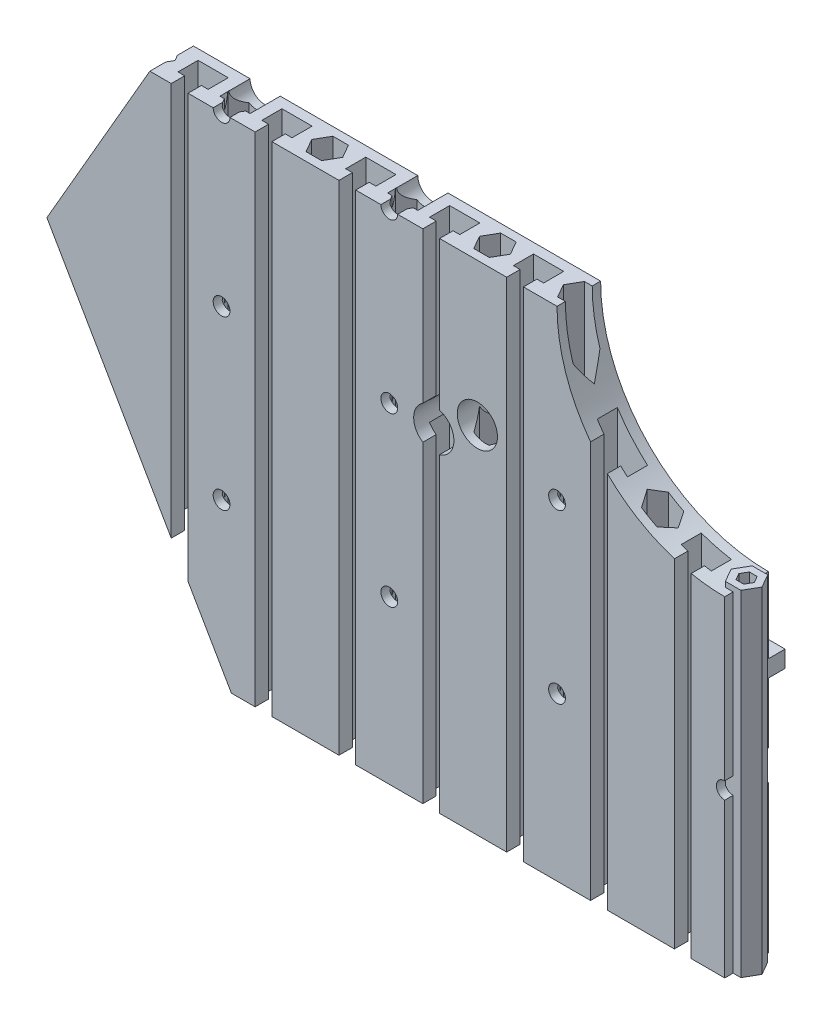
SolidWorks part; units mm, degrees
ref_plane "Plan de face" through (0, 0, 0) normal (0, 0, 1) x (1, 0, 0)
ref_plane "Plan de dessus" through (0, 0, 0) normal (0, 1, 0) x (1, 0, 0)
ref_plane "Plan de droite" through (0, 0, 0) normal (1, 0, 0) x (0, 0, -1)
sketch "Esquisse1" plane through (0, 0, 0) normal (0, 0, 1) x (1, 0, 0)
  line L6 (35.7636, 358.7862) -> (-423.8647, -437.3133) construction
  line L7 (-755.4678, -148.4209) -> (879.7592, -148.4209) construction
  line L8 (-46.1325, 376.7457) -> (415.4529, -422.7436) construction
  line L9 (257.0726, -148.4209) -> (-245.0999, 141.5085) construction
  line L10 (-257.0726, -148.4209) -> (263.2247, 151.9729) construction
  line L11 (-55, 201.5791) -> (55, 201.5791)
  line L12 (-147.0726, -148.4209) -> (147.0726, -148.4209)
  line L13 (147.0726, -148.4209) -> (202.0726, -53.1581)
  line L14 (202.0726, -53.1581) -> (55, 201.5791)
  line L15 (-147.0726, -148.4209) -> (-202.0726, -53.1581)
  line L16 (-202.0726, -53.1581) -> (-55, 201.5791)
  dimension "D1" = 60
  dimension "D2" = 60
  dimension "D3" = 110
  dimension "D4" = 350
  dimension "D5" = 60
  dimension "D6" = 60
  dimension "D7" = 110
  dimension "D8" = 110
extrude "Boss.-Extru.2" add sketch "Esquisse1" along normal blind 13
sketch "Esquisse3" plane through (0, 201.5791, 0) normal (0, 1, 0) x (1, 0, 0)
  line L0 (-12.5, 6.793) -> (-12.5, -19.2478) construction
  line L1 (-8, -3) -> (-17, -3)
  line L2 (-17, -3) -> (-17, -9)
  line L3 (-17, -9) -> (-15, -9)
  line L4 (-15, -9) -> (-15, -13)
  line L5 (55, -13) -> (-55, -13) construction
  line L6 (-10, -9) -> (-10, -13)
  line L7 (-8, -9) -> (-10, -9)
  line L8 (-8, -3) -> (-8, -9)
  line L9 (-15, -13) -> (-10, -13)
  point P2 (-12.5, -13)
  point P14 (-12.5, -3)
  dimension "D1" = 12.5
  dimension "D2" = 9
  dimension "D3" = 5
  dimension "D4" = 6
  dimension "D5" = 4
extrude "Enlèv. mat.-Extru.1" cut sketch "Esquisse3" against normal up to next
pattern_linear "Répétition linéaire1" count 8 spacing 25 along (1, 0, 0) of "Enlèv. mat.-Extru.1"
pattern_linear "Répétition linéaire2" count 7 spacing 25 along (-1, 0, 0) of "Enlèv. mat.-Extru.1"
sketch "3parties" plane through (0, 0, 0) normal (0, 0, 1) x (1, 0, 0)
  line L0 (-147.0726, -148.4209) -> (147.0726, -148.4209) construction
  line L1 (147.0726, -148.4209) -> (202.0726, -53.1581) construction
  line L2 (-50, 0) -> (-171.3817, 0)
  line L3 (-165, 11.0535) -> (-202.0726, -53.1581) construction
  line L4 (50, 0) -> (171.3817, 0)
  line L5 (202.0726, -53.1581) -> (165, 11.0535) construction
  line L6 (0, -50) -> (0, -148.4209)
  line L7 (-10, -148.4209) -> (10, -148.4209) construction
  line L8 (202.0726, -53.1581) -> (55, 201.5791) construction
  line L9 (-55, 201.5791) -> (55, 201.5791) construction
  line L10 (-202.0726, -53.1581) -> (-55, 201.5791) construction
  line L11 (-147.0726, -148.4209) -> (147.0726, -148.4209)
  line L12 (147.0726, -148.4209) -> (202.0726, -53.1581)
  line L13 (202.0726, -53.1581) -> (55, 201.5791)
  line L14 (-55, 201.5791) -> (55, 201.5791)
  line L15 (-202.0726, -53.1581) -> (-55, 201.5791)
  circle A0 centre (0, 0) radius 50
  dimension "D1" = 100
sketch "certcleRotules" plane through (0, 0, 13) normal (0, 0, 1) x (1, 0, 0)
  circle A0 centre (0, 0) radius 157.5
  dimension "D1" = 315
sketch "Esquisse6" plane through (0, 0, 0) normal (0, 1, 0) x (1, 0, 0)
  line L0 (-157.5, -13) -> (157.5, -13) construction
  line L1 (0, 0) -> (-4.5, 0)
  line L2 (0, 0) -> (0, -13)
  line L3 (-2.5, -9) -> (-4.5, -9)
  line L4 (-4.5, 0) -> (-4.5, -9)
  line L7 (0, -13) -> (-2.5, -13)
  line L8 (-2.5, -9) -> (-2.5, -13)
  dimension "D1" = 4.5
  dimension "D2" = 2.5
  dimension "D3" = 4
revolve "Enlèvement de matière-Révolution1" cut sketch "Esquisse6" angle 360 about L2
pattern_linear "Répétition linéaire3" count 4 spacing 50 along (0, 1, 0) count 4 spacing 50 along (1, 0, 0) of "Enlèvement de matière-Révolution1"
pattern_linear "Répétition linéaire5" count 3 spacing 50 along (0, -1, 0) count 4 spacing 50 along (1, 0, 0) of "Enlèvement de matière-Révolution1"
pattern_linear "Répétition linéaire6" count 4 spacing 50 along (0, 1, 0) count 4 spacing 50 along (-1, 0, 0) of "Enlèvement de matière-Révolution1"
pattern_linear "Répétition linéaire7" count 3 spacing 50 along (0, -1, 0) count 4 spacing 50 along (-1, 0, 0) of "Enlèvement de matière-Révolution1"
sketch "Esquisse8" plane through (0, 0, 0) normal (0, 0, -1) x (-1, 0, 0)
  circle A0 centre (0, 100) radius 4.5 construction
  circle A1 centre (0, 100) radius 4.5
extrude "bouchonBarreauHaut" add sketch "Esquisse8" against normal blind 13
sketch "Esquisse7" plane through (0, 0, 0) normal (0, 0, -1) x (-1, 0, 0)
  line L1 (-6.5, 105.15) -> (6.5, 105.15)
  line L2 (-6.5, 105.15) -> (-6.5, 80.15)
  line L3 (-6.5, 80.15) -> (6.5, 80.15)
  line L4 (6.5, 105.15) -> (6.5, 80.15)
  line L5 (0, 9.9) -> (0, -9.9) construction
  dimension "D1" = 25
  dimension "D2" = 80.15
  dimension "D3" = 13
  dimension "D4" = 6.5
extrude "Boss.-Extru.4" add sketch "Esquisse7" along normal blind 5
sketch "Esquisse9" plane through (0, 0, 0) normal (1, 0, 0) x (0, 0, -1)
  line L0 (5, 80.15) -> (0, 80.15) construction
  line L1 (5, 80.15) -> (5, 105.15) construction
  line L3 (5, 85.15) -> (5, 82.5)
  line L4 (5, 82.5) -> (-3, 82.5)
  line L6 (-3, -148.4209) -> (-3, 201.5791) construction
  line L7 (-13, 157.5) -> (-13, -157.5) construction
  line L8 (-3, 79.15) -> (-13, 79.15)
  line L9 (-3, 79.15) -> (-3, 82.5)
  line L10 (5, 85.15) -> (-13, 85.15)
  line L11 (-13, 79.15) -> (-13, 85.15)
  dimension "D1" = 5
  dimension "D2" = 2.65
  dimension "D3" = 6
revolve "Enlèvement de matière-Révolution2" cut sketch "Esquisse9" angle 360 about L10
pattern_linear "Répétition linéaire8" count 2 spacing 15 along (0, 1, 0) of "Enlèvement de matière-Révolution2"
pattern_circular "Répétition circulaire1" count 3 every 120 about axis through (0, 0, 0) along (0, 0, 1) of "Boss.-Extru.4", "Enlèvement de matière-Révolution2", "Répétition linéaire8"
sketch "Esquisse10" plane through (0, 0, 0) normal (1, 0, 0) x (0, 0, -1)
  line L0 (0, 201.5791) -> (0, -53.1581) construction
  line L1 (0, 77.5) -> (5, 77.5)
  line L2 (0, 77.5) -> (0, 72.5)
  line L3 (0, 72.5) -> (5, 72.5)
  line L4 (5, 77.5) -> (5, 72.5)
  line L5 (0, 50) -> (0, -50) construction
  line L6 (0, -72.5) -> (5, -72.5)
  line L7 (0, -72.5) -> (0, -77.5)
  line L8 (0, -77.5) -> (5, -77.5)
  line L9 (5, -72.5) -> (5, -77.5)
  line L10 (5, 80.15) -> (5, 105.15) construction
  line L11 (-9, 50) -> (0, 50) construction
  line L13 (-9, -100) -> (0, -100) construction
  point P16 (2.5, 72.5)
  point P19 (2.5, -72.5)
  dimension "D1" = 22.5
  dimension "D2" = 5
  dimension "D3" = 22.5
  dimension "D4" = 5
extrude "Boss.-Extru.6" add sketch "Esquisse10" along normal mid plane 250
chamfer "Chanfrein1" distance 5 angle 60 4 edges at (125, -75, -5) (-125, -75, -5) (-125, 75, -5) (125, 75, -5)
sketch "Esquisse11" plane through (0, 0, 13) normal (0, 0, 1) x (1, 0, 0)
  line L0 (-10, -148.4209) -> (-10, 201.5791) construction
  line L1 (-10, 23.5) -> (10, 23.5)
  line L2 (-10, 23.5) -> (-10, -23.5)
  line L3 (-10, -23.5) -> (10, -23.5)
  line L4 (10, 23.5) -> (10, -23.5)
  line L5 (10, -148.4209) -> (10, 201.5791) construction
  dimension "D1" = 47
  dimension "D2" = 23.5
extrude "Enlèv. mat.-Extru.2" cut sketch "Esquisse11" against normal blind 8.9
sketch "Esquisse13" plane through (-8, 0, 0) normal (-1, 0, 0) x (0, 0, 1)
  line L1 (4.1, -23.5) -> (11.1, -23.5)
  line L2 (4.1, -23.5) -> (4.1, -40)
  line L3 (4.1, -40) -> (6.1, -40)
  line L4 (11.1, -23.5) -> (11.1, -35)
  arc A0 (6.1, -40) -> (11.1, -35) centre (6.1, -35) ccw
  dimension "D2" = 5
  dimension "D1" = 16.5
  dimension "D3" = 7
extrude "Enlèv. mat.-Extru.3" cut sketch "Esquisse13" against normal up to surface (16 mm away)
sketch "Esquisse14" plane through (0, 0, 4.1) normal (0, 0, 1) x (1, 0, 0)
  line L0 (-8, 23.5) -> (-8, -40) construction
  line L1 (-3, -20) -> (3, -20)
  line L2 (-8, -25) -> (-8, -35)
  line L3 (-3, -40) -> (3, -40)
  line L4 (8, -25) -> (8, -35)
  line L5 (8, -40) -> (8, 23.5) construction
  line L6 (8, -40) -> (-8, -40) construction
  arc A0 (-8, -35) -> (-3, -40) centre (-3, -35) ccw
  arc A1 (3, -40) -> (8, -35) centre (3, -35) ccw
  arc A2 (3, -20) -> (8, -25) centre (3, -25) cw
  arc A3 (-3, -20) -> (-8, -25) centre (-3, -25) ccw
  point P16 (8, -20)
  point P19 (-8, -20)
  dimension "D3" = 5
  dimension "D1" = 20
extrude "Enlèv. mat.-Extru.4" cut sketch "Esquisse14" against normal up to next
mirror "Symétrie1" about plane through (0, 0, 0) normal (0, 1, 0) of "Enlèv. mat.-Extru.4", "Enlèv. mat.-Extru.3"
sketch "Esquisse15" plane through (0, 0, 0) normal (0, 0, -1) x (-1, 0, 0)
  circle A0 centre (-50, 0) radius 4.5 construction
  circle A1 centre (0, -50) radius 4.5 construction
  circle A2 centre (50, 0) radius 4.5 construction
  circle A3 centre (0, 50) radius 4.5 construction
  circle A4 centre (-50, 0) radius 4.5
  circle A5 centre (0, -50) radius 4.5
  circle A6 centre (50, 0) radius 4.5
  circle A7 centre (0, 50) radius 4.5
extrude "boucheTrousCEntre" add sketch "Esquisse15" against normal up to surface (13 mm away)
sketch "Esquisse16" plane through (0, -148.4209, 0) normal (0, -1, 0) x (1, 0, 0)
  line L0 (0, -9.9) -> (0, 9.9) construction
  line L1 (-2.3094, 2.5) -> (2.3094, 2.5)
  line L2 (2.3094, 2.5) -> (4.6188, 6.5)
  line L3 (4.6188, 6.5) -> (2.3094, 10.5)
  line L4 (2.3094, 10.5) -> (-2.3094, 10.5)
  line L5 (-2.3094, 10.5) -> (-4.6188, 6.5)
  line L6 (-4.6188, 6.5) -> (-2.3094, 2.5)
  line L8 (-10, 13) -> (10, 13) construction
  circle A0 centre (0, 6.5) radius 4 construction
  dimension "D1" = 6.5
  dimension "D2" = 8
extrude "Enlèv. mat.-Extru.5" cut sketch "Esquisse16" against normal through all
pattern_linear "Répétition linéaire9" count 8 spacing 25 along (1, 0, 0) of "Enlèv. mat.-Extru.5"
pattern_linear "Répétition linéaire10" count 8 spacing 25 along (-1, 0, 0) of "Enlèv. mat.-Extru.5"
sketch "Esquisse20" plane through (0, 0, 0) normal (0, 0, 1) x (1, 0, 0)
  line L0 (-50, 0) -> (-171.3817, 0) construction
  line L1 (-202.0726, -53.1581) -> (-55, 201.5791) construction
  line L2 (-55, 201.5791) -> (55, 201.5791) construction
  line L3 (202.0726, -53.1581) -> (55, 201.5791) construction
  line L4 (147.0726, -148.4209) -> (202.0726, -53.1581) construction
  line L5 (-147.0726, -148.4209) -> (147.0726, -148.4209) construction
  line L6 (0, -50) -> (0, -148.4209) construction
  line L7 (-50, 0) -> (-171.3817, 0)
  line L8 (-171.3817, 0) -> (-55, 201.5791)
  line L9 (-55, 201.5791) -> (55, 201.5791)
  line L10 (202.0726, -53.1581) -> (55, 201.5791)
  line L11 (147.0726, -148.4209) -> (202.0726, -53.1581)
  line L12 (0, -148.4209) -> (147.0726, -148.4209)
  line L13 (0, -50) -> (0, -148.4209)
  circle A0 centre (0, 0) radius 50 construction
  arc A1 (-50, 0) -> (0, -50) centre (0, 0) ccw
extrude "Enlèv. mat.-Extru.8" cut sketch "Esquisse20" against normal through all both and the other way through all
sketch "Esquisse21" plane through (0, -148.4209, 0) normal (0, -1, 0) x (1, 0, 0)
  line L0 (-2.3094, 10.5) -> (-4.6188, 6.5) construction
  line L1 (4.6188, 6.5) -> (2.3094, 10.5)
  line L2 (2.3094, 10.5) -> (-2.3094, 10.5)
  line L3 (-2.3094, 10.5) -> (-4.6188, 6.5)
  line L4 (-4.6188, 6.5) -> (-2.3094, 2.5)
  line L5 (-2.3094, 2.5) -> (2.3094, 2.5)
  line L6 (2.3094, 2.5) -> (4.6188, 6.5)
  line L7 (-4.6188, 6.5) -> (-2.3094, 2.5) construction
  line L9 (1.1547, 4.5) -> (2.3094, 6.5)
  line L10 (2.3094, 6.5) -> (1.1547, 8.5)
  line L11 (1.1547, 8.5) -> (-1.1547, 8.5)
  line L12 (-1.1547, 8.5) -> (-2.3094, 6.5)
  line L13 (-2.3094, 6.5) -> (-1.1547, 4.5)
  line L14 (-1.1547, 4.5) -> (1.1547, 4.5)
  circle A0 centre (0, 6.5) radius 4 construction
  circle A1 centre (0, 6.5) radius 2 construction
  point P12 (-0.1093, 6.5946)
  dimension "D1" = 4
extrude "Boss.-Extru.7" add sketch "Esquisse21" against normal blind 100
